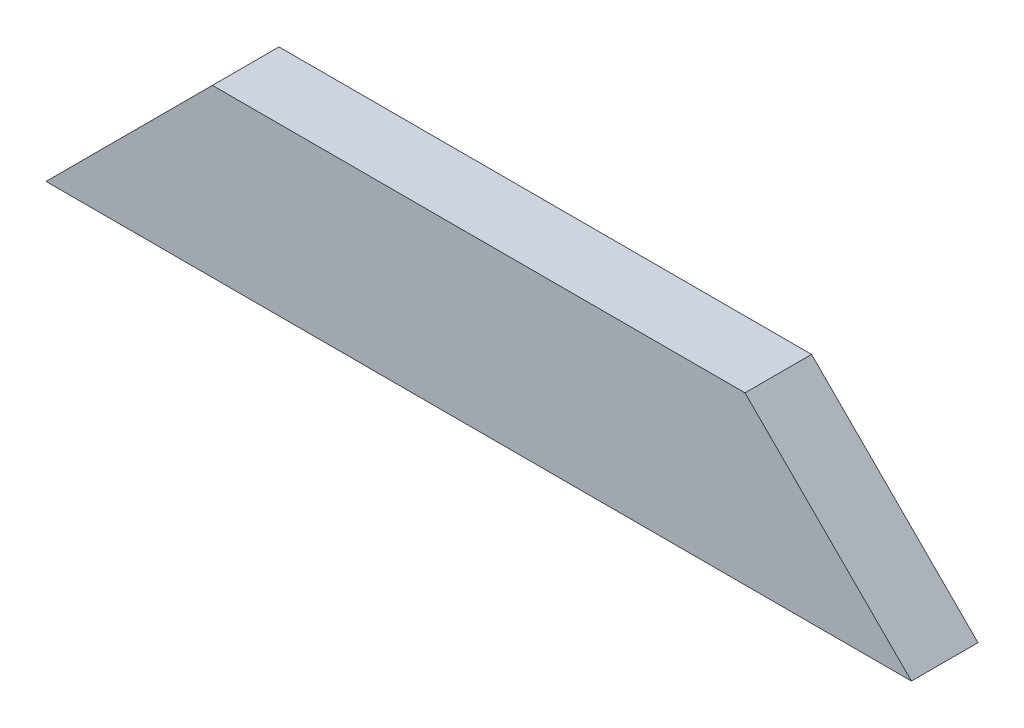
SolidWorks part; units mm, degrees
ref_plane "Front Plane" through (0, 0, 0) normal (0, 0, 1) x (1, 0, 0)
ref_plane "Top Plane" through (0, 0, 0) normal (0, 1, 0) x (1, 0, 0)
ref_plane "Right Plane" through (0, 0, 0) normal (1, 0, 0) x (0, 0, -1)
sketch "Sketch1" plane through (0, 0, 0) normal (0, 0, 1) x (1, 0, 0)
  line L0 (65, 0) -> (-65, 0)
  line L1 (-65, 0) -> (-40, 25)
  line L2 (-40, 25) -> (40, 25)
  line L3 (40, 25) -> (65, 0)
  point P4 (0, 0)
  dimension "D1" = 130
  dimension "D2" = 25
  dimension "D3" = 45
  dimension "D4" = 45
extrude "Boss-Extrude1" add sketch "Sketch1" against normal blind 10
